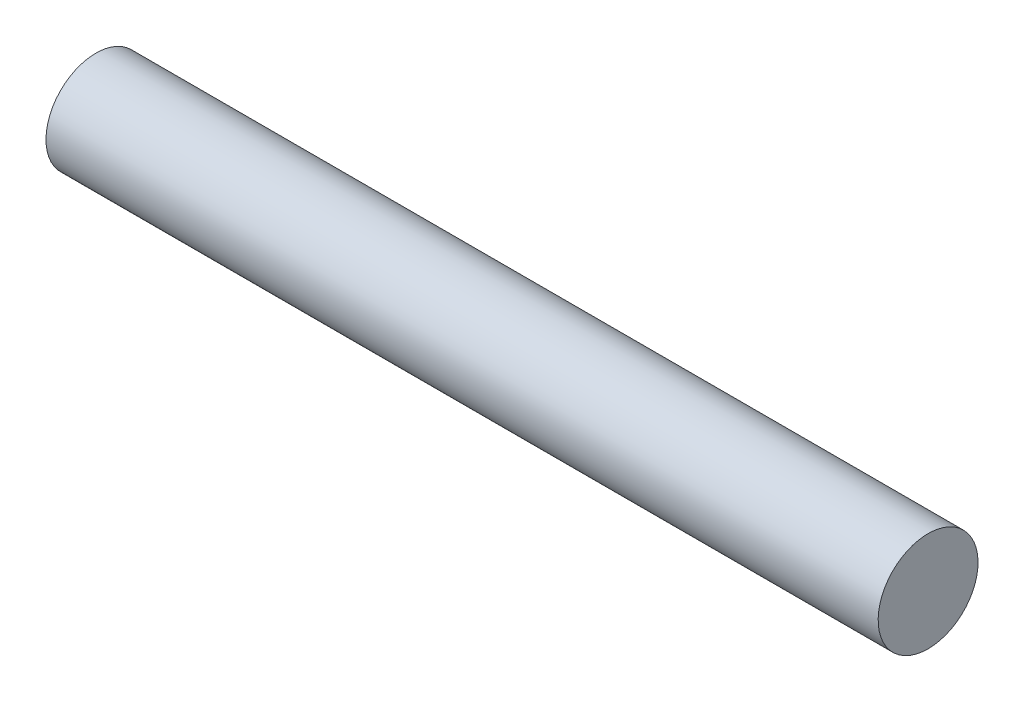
SolidWorks part; units mm, degrees
ref_plane "Plan1" through (0, 0, 0) normal (0, 0, 1) x (1, 0, 0)
ref_plane "Plan2" through (0, 0, 0) normal (0, 1, 0) x (1, 0, 0)
ref_plane "Plan3" through (0, 0, 0) normal (1, 0, 0) x (0, 0, -1)
sketch "Esquisse1" plane through (0, 0, 0) normal (0, 0, 1) x (1, 0, 0)
  line L0 (0, 0) -> (0, 1.5)
  line L1 (0, 1.5) -> (25, 1.5)
  line L2 (25, 1.5) -> (25, 0)
  line L3 (0, 0) -> (25, 0) construction
  line L4 (0, 0) -> (25, 0)
  dimension "D1" = 25
  dimension "D2" = 1.5
revolve "Base-Révolution" add sketch "Esquisse1" angle 360 about L3
